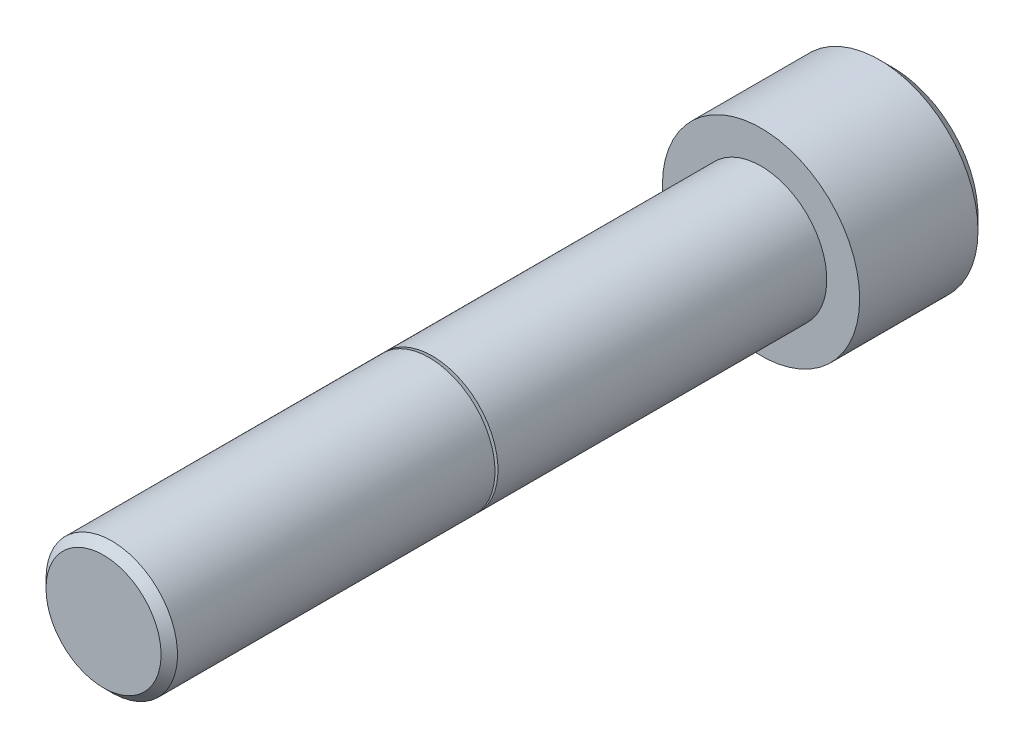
SolidWorks part; units mm, degrees
ref_plane "Front" through (0, 0, 0) normal (0, 0, 1) x (1, 0, 0)
ref_plane "Top" through (0, 0, 0) normal (0, 1, 0) x (1, 0, 0)
ref_plane "Right" through (0, 0, 0) normal (1, 0, 0) x (0, 0, -1)
sketch "Logo3_Revol_Axis" plane through (0, 0, 0) normal (0, 1, 0) x (1, 0, 0)
  line L0 (0, -43.5172) -> (0, 43.5172) construction
sketch "Logo3_bib1" plane through (0, 0, 0) normal (0, -1, 0) x (-1, 0, 0)
  line L0 (0, -127) -> (0, 25.4)
  line L1 (0, 25.4) -> (16.51, 25.4)
  line L2 (19.05, 22.86) -> (19.05, 0)
  line L3 (19.05, 0) -> (12.7, 0)
  line L4 (12.7, 0) -> (12.7, -63.51)
  line L5 (12.7, -125.4125) -> (11.1125, -127)
  line L6 (11.1125, -127) -> (0, -127)
  line L7 (12.7, -63.51) -> (11.2259, -63.51)
  line L8 (11.2191, -63.5488) -> (12.7, -64.0878)
  line L9 (12.7, -64.0878) -> (12.7, -125.4125)
  line L10 (0, 10.5852) -> (0, -63.2873) construction
  line L11 (16.51, 25.4) -> (19.05, 22.86)
  arc A1 (11.2259, -63.51) -> (11.2191, -63.5488) centre (11.2259, -63.53) ccw
  point P17 (11.1125, -63.51)
  point P19 (19.05, 25.4)
revolve "Revolve1" add sketch "Logo3_bib1" angle 360 about L10
sketch "Logo3_bib2" plane through (0, 0, -25.4) normal (0, 0, -1) x (1, 0, 0)
  line L1 (10.9985, 0) -> (5.4993, 9.525)
  line L2 (5.4993, 9.525) -> (-5.4993, 9.525)
  line L3 (-5.4993, 9.525) -> (-10.9985, 0)
  line L4 (-10.9985, 0) -> (-5.4993, -9.525)
  line L5 (-5.4993, -9.525) -> (5.4993, -9.525)
  line L6 (5.4993, -9.525) -> (10.9985, 0)
  circle A0 centre (0, 0) radius 9.525 construction
  dimension "Logo3_c1" = 4.7625
extrude "Cut-Extrude1" cut sketch "Logo3_bib2" against normal blind 12.7
equation "\"DIA2@Logo3_bib1\" = \"Logo3_d1-pas@Logo3_bib1\""
equation "\"LGT1@Logo3_bib1\" = \"Logo3_d1@Logo3_bib1\""
equation "\"D1@Cut-Extrude1\" = \"Logo3_d1@Logo3_bib1\"/2."
equation "\"D2@Cosmetic Thread1\" = \"Logo3_d1-pas@Logo3_bib1\""
equation "\"D5@Logo3_bib1\"=\"Logo3_d1@Logo3_bib1\"*.1"
